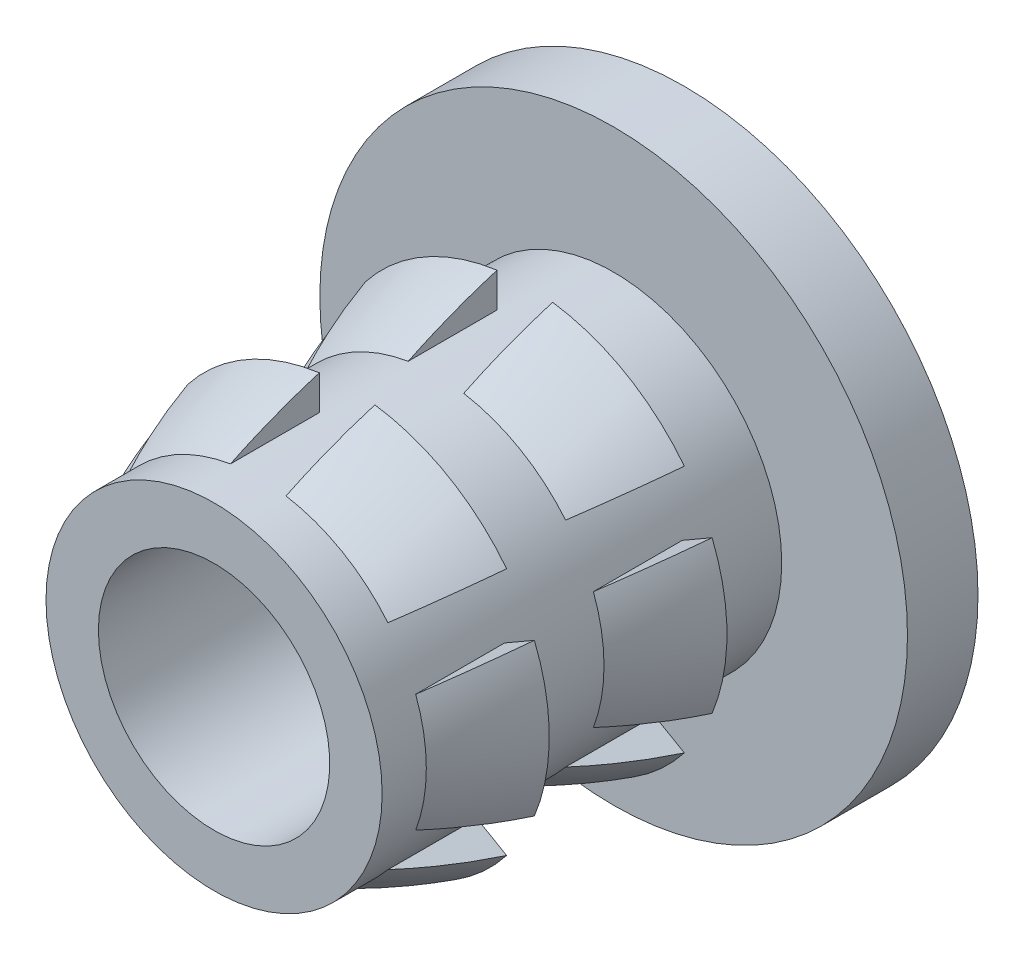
SolidWorks part; units mm, degrees
other "<flanged insert M3X0.5 short (3005SF8-6)>-<Move Face1>"
ref_plane "Front Plane" through (0, 0, 0) normal (0, 0, 1) x (1, 0, 0)
ref_plane "Top Plane" through (0, 0, 0) normal (0, 1, 0) x (1, 0, 0)
ref_plane "Right Plane" through (0, 0, 0) normal (1, 0, 0) x (0, 0, -1)
inserted part "flanged insert M3X0.5 short (3005SF8-6)"
